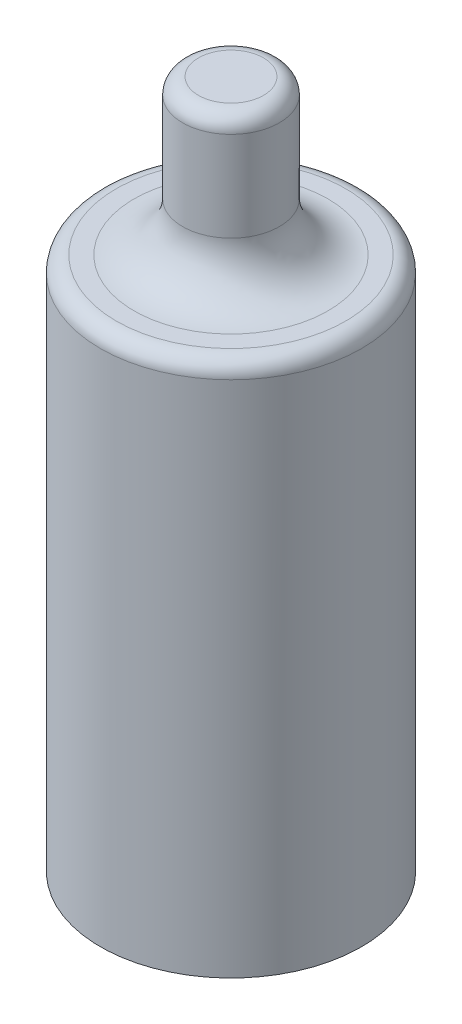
SolidWorks part; units mm, degrees
ref_plane "front" through (0, 0, 0) normal (0, 0, 1) x (1, 0, 0)
ref_plane "top" through (0, 0, 0) normal (0, 1, 0) x (1, 0, 0)
ref_plane "side" through (0, 0, 0) normal (1, 0, 0) x (0, 0, -1)
sketch "Sketch1" plane through (0, 0, 0) normal (0, 0, 1) x (1, 0, 0)
  line L0 (0, 16.5354) -> (0.781, 16.5354)
  line L1 (0, -50) -> (0, 50) construction
  line L2 (1.162, 16.1544) -> (1.162, 13.9954)
  line L3 (2.3305, 12.827) -> (3.1369, 12.827)
  line L4 (3.1369, 12.827) -> (3.1369, 0)
  line L5 (50, 0) -> (-50, 0) construction
  line L6 (3.1369, 0) -> (2.4003, 0)
  line L7 (2.4003, 0) -> (2.4003, 7.7018)
  line L8 (2.4003, 7.7018) -> (0, 9.144)
  line L9 (0, 9.144) -> (0, 16.5354)
  line L10 (0, 0) -> (0, 19.9613) construction
  arc A0 (1.162, 13.9954) -> (2.3305, 12.827) centre (2.3304, 13.9954) ccw
  arc A1 (0.781, 16.5354) -> (1.162, 16.1544) centre (0.781, 16.1544) cw
  dimension "D8" = 1.1684
  dimension "D9" = 0.381
  dimension "D1" = 2.3241
  dimension "D2" = 6.2738
  dimension "D3" = 4.8006
  dimension "D4" = 12.827
  dimension "D5" = 16.5354
  dimension "D6" = 9.144
  dimension "D7" = 59
revolve "Revolve1" add sketch "Sketch1" angle 360 about L10
fillet "Fillet1" radius 0.381 1 edges at (0, 12.827, -3.1369)
